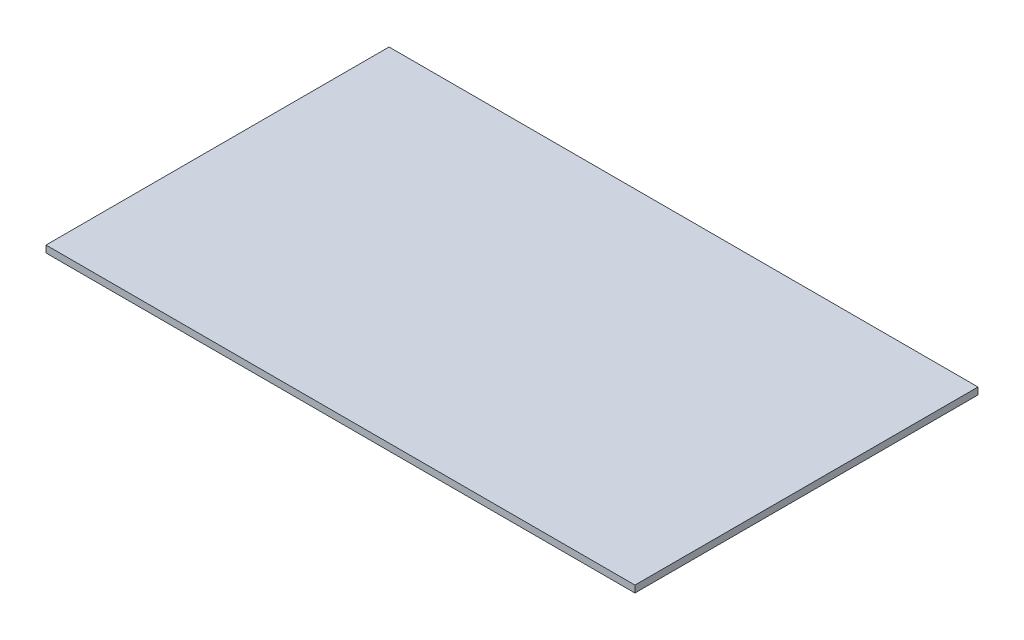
SolidWorks part; units mm, degrees
ref_plane "前视基准面" through (0, 0, 0) normal (0, 0, 1) x (1, 0, 0)
ref_plane "上视基准面" through (0, 0, 0) normal (0, 1, 0) x (1, 0, 0)
ref_plane "右视基准面" through (0, 0, 0) normal (1, 0, 0) x (0, 0, -1)
other "Configuration Table"
sketch "草图1" plane through (0, 0, 0) normal (0, 0, 1) x (1, 0, 0)
  line L1 (0, 0) -> (255.8, 0)
  line L2 (0, 0) -> (0, 3)
  line L3 (0, 3) -> (255.8, 3)
  line L4 (255.8, 0) -> (255.8, 3)
extrude "V2_REF_chassis_255p8x149" add sketch "草图1" along normal blind 149
